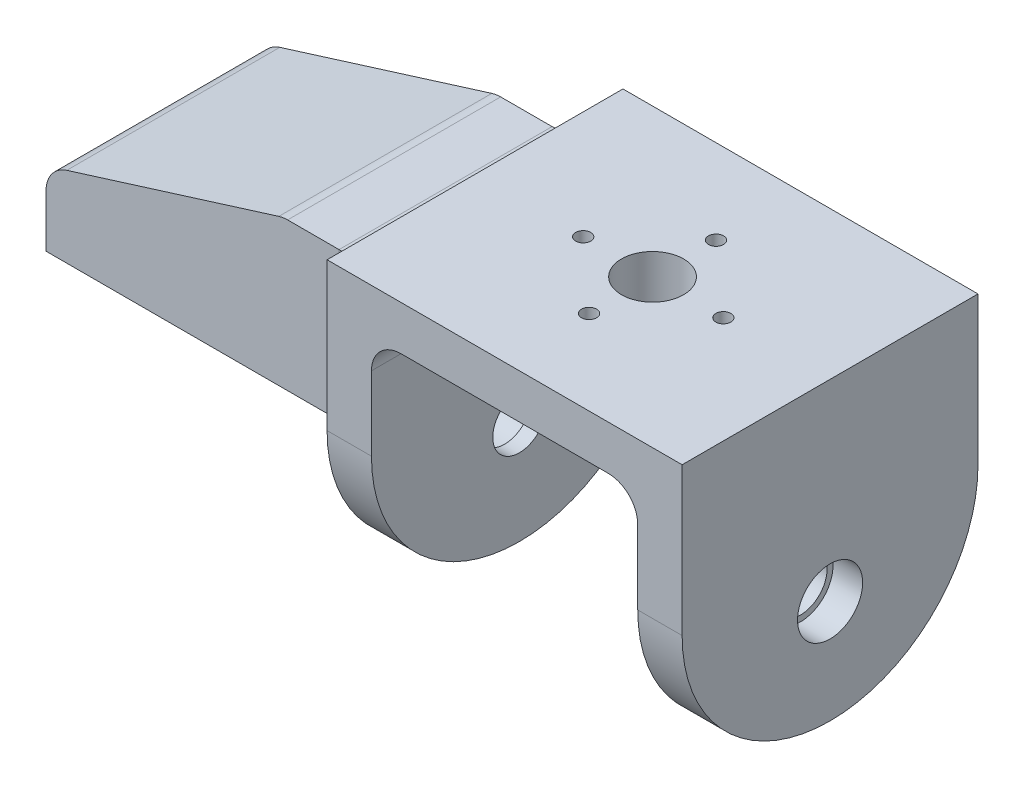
SolidWorks part; units mm, degrees
ref_plane "Front Plane" through (0, 0, 0) normal (0, 0, 1) x (1, 0, 0)
ref_plane "Top Plane" through (0, 0, 0) normal (0, 1, 0) x (1, 0, 0)
ref_plane "Right Plane" through (0, 0, 0) normal (1, 0, 0) x (0, 0, -1)
sketch "Sketch1" plane through (0, 0, 0) normal (0, 0, 1) x (1, 0, 0)
  line L0 (0, 0) -> (0, -100)
  line L1 (0, -100) -> (15, -100)
  line L2 (0, 0) -> (120, 0)
  line L3 (120, 0) -> (120, -100)
  line L4 (120, -100) -> (105, -100)
  line L5 (105, -100) -> (105, -15)
  line L6 (15, -15) -> (105, -15)
  line L7 (15, -100) -> (15, -15)
  dimension "D1" = 100
  dimension "D2" = 15
  dimension "D3" = 120
  dimension "D4" = 100
  dimension "D5" = 15
  dimension "D6" = 15
extrude "Boss-Extrude1" add sketch "Sketch1" along normal blind 100
sketch "Sketch2" plane through (0, 0, 0) normal (-1, 0, 0) x (0, 0, 1)
  line L2 (0, -50) -> (100, -50) construction
  line L3 (0, 0) -> (0, -100) construction
  line L4 (100, 0) -> (100, -100) construction
  line L5 (50, 0) -> (50, -100) construction
  line L6 (100, 0) -> (0, 0) construction
  line L7 (100, -100) -> (0, -100) construction
  circle A0 centre (50, -65) radius 9
  dimension "D1" = 18
  dimension "D2" = 15
extrude "Cut-Extrude1" cut sketch "Sketch2" against normal through all
sketch "Sketch3" plane through (0, -15, 0) normal (0, -1, 0) x (-1, 0, 0)
  line L0 (-105, -50) -> (-15, -50) construction
  line L3 (-60, -100) -> (-60, 0) construction
  line L4 (-15, -100) -> (-105, -100) construction
  line L5 (-15, 0) -> (-105, 0) construction
  line L6 (-83.95, -50) -> (-36.55, -50) construction
  line L7 (-83.95, -50) -> (-36.55, -50) construction
  line L8 (-60, -28.55) -> (-60, -71.45) construction
  line L9 (-105, -100) -> (-105, 0) construction
  line L10 (-15, -100) -> (-15, 0) construction
  circle A14 centre (-83.95, -50) radius 2.55
  circle A15 centre (-36.55, -50) radius 2.55
  circle A16 centre (-60, -28.55) radius 2.55
  circle A17 centre (-60, -71.45) radius 2.55
  point P0 (-60, -50)
  point P14 (-60, -50)
  point P32 (25.94, -50)
  dimension "D2" = 48
  dimension "D4" = 26
  dimension "D6" = 5.1
  dimension "D7" = 5.1
  dimension "D8" = 5.1
  dimension "D9" = 5.1
  dimension "D10" = 52.5
extrude "Cut-Extrude2" cut sketch "Sketch3" against normal through all
fillet "Fillet1" radius 50 4 edges at (112.5, -100, 0) (112.5, -100, 100) (7.5, -100, 100) (7.5, -100, 0)
sketch "Sketch5" plane through (0, 0, 0) normal (-1, 0, 0) x (0, 0, 1)
  line L0 (100, 0) -> (0, 0) construction
  line L3 (14, -44) -> (86, -44)
  line L5 (50, 0) -> (50, -100) construction
  line L6 (14, -29) -> (86, -29)
  line L7 (14, -44) -> (14, -29)
  line L8 (86, -44) -> (86, -29)
  line L9 (100, 0) -> (100, -50) construction
  circle A0 centre (50, -65) radius 9 construction
  dimension "D1" = 21
  dimension "D2" = 15
  dimension "D3" = 14
  dimension "D4" = 72
fillet "Fillet3" radius 10 2 edges at (105, -15, 50) (15, -15, 50)
fillet "Fillet4" [suppressed] radius 2
extrude "Boss-Extrude2" add sketch "Sketch5" along normal blind 109
sketch "Sketch6" plane through (0, -44, 0) normal (0, -1, 0) x (-1, 0, 0)
  line L0 (0, -14) -> (109, -14)
  line L1 (109, -14) -> (109, -86)
  line L2 (109, -86) -> (0, -86)
  line L3 (0, -86) -> (0, -73)
  line L4 (0, -100) -> (0, -50) construction
  line L5 (0, -73) -> (96, -73)
  line L6 (96, -73) -> (96, -27)
  line L7 (96, -27) -> (0, -27)
  line L8 (0, -50) -> (0, 0) construction
  dimension "D1" = 13
  dimension "D2" = 96
  dimension "D3" = 13
extrude "Boss-Extrude3" add sketch "Sketch6" along normal blind 15 contours L7 L6 L5 M3 M4 M5 M6
sketch "Sketch7" plane through (0, 0, 0) normal (-1, 0, 0) x (0, 0, 1)
  line L1 (86, -29) -> (14, -29)
  line L2 (86, -29) -> (86, -9)
  line L3 (86, -9) -> (14, -9)
  line L4 (14, -29) -> (14, -9)
  dimension "D1" = 20
  dimension "D2" = 72
extrude "Boss-Extrude4" add sketch "Sketch7" along normal blind 109
sketch "Sketch8" plane through (0, 0, 86) normal (0, 0, 1) x (1, 0, 0)
  line L4 (0, 0) -> (-109, 0)
  line L5 (-109, -59) -> (-109, -9) construction
  line L6 (-109, 0) -> (-109, -34)
  line L7 (-109, -34) -> (0, 0)
extrude "Cut-Extrude3" cut sketch "Sketch8" against normal through all
sketch "Sketch11" plane through (120, 0, 0) normal (1, 0, 0) x (0, 0, -1)
  circle A0 centre (-50, -65) radius 11
  dimension "D1" = 22
extrude "Cut-Extrude4" cut sketch "Sketch11" against normal blind 10
sketch "Sketch12" plane through (0, 0, 0) normal (-1, 0, 0) x (0, 0, 1)
  circle A0 centre (50, -65) radius 11
  dimension "D1" = 22
extrude "Cut-Extrude5" cut sketch "Sketch12" against normal blind 10
fillet "Fillet7" radius 10 5 edges at (0, -34, 14) (0, -34, 86) (0, -9, 50) (-28.8529, -9, 50) (-109, -34, 50)
sketch "Sketch14" plane through (0, -15, 0) normal (0, -1, 0) x (-1, 0, 0)
  line L0 (-60, -100) -> (-60, 0) construction
  line L1 (-25, -100) -> (-95, -100) construction
  line L2 (-25, 0) -> (-95, 0) construction
  line L3 (-15, -50) -> (-105, -50) construction
  line L4 (-15, -100) -> (-15, 0) construction
  line L5 (-105, -100) -> (-105, 0) construction
  circle A0 centre (-60, -50) radius 10.5
  dimension "D1" = 21
extrude "Cut-Extrude6" cut sketch "Sketch14" against normal through all
